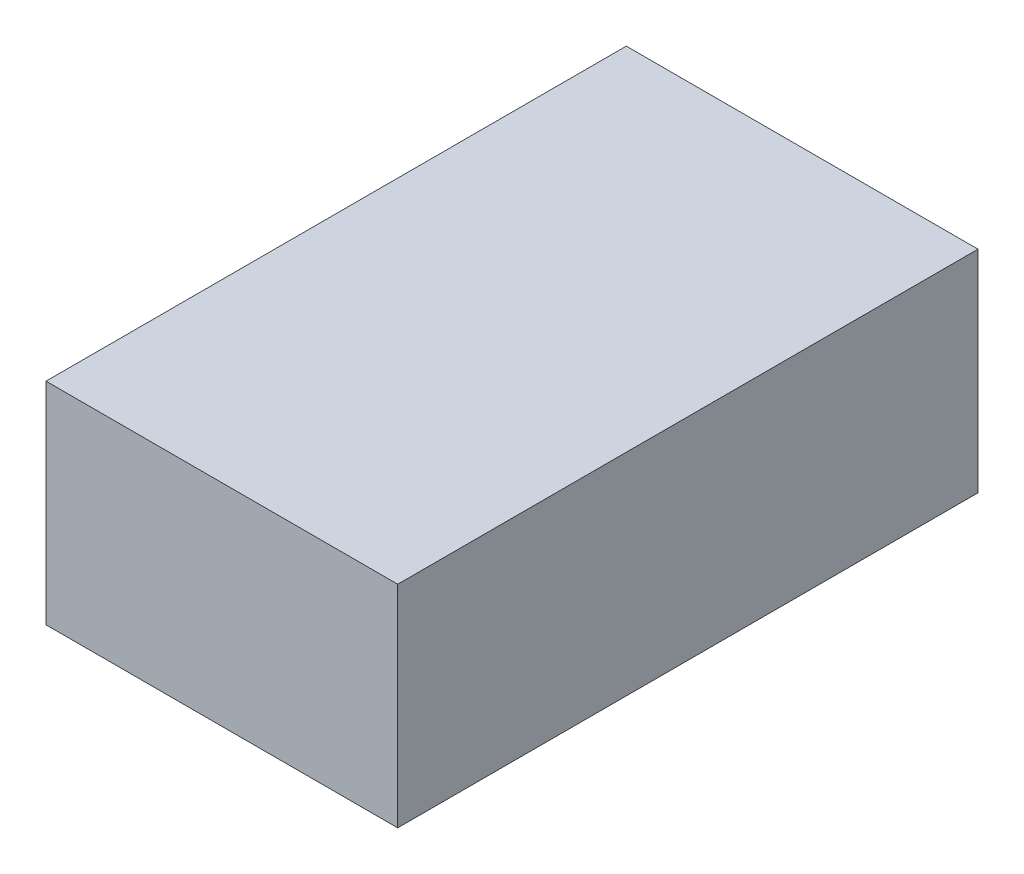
SolidWorks part; units mm, degrees
ref_plane "Front Plane" through (0, 0, 0) normal (1, 0, 0) x (0, 1, 0)
ref_plane "Top Plane" through (0, 0, 0) normal (0, 0, 1) x (0, 1, 0)
ref_plane "Right Plane" through (0, 0, 0) normal (0, 1, 0) x (-1, 0, 0)
sketch "Sketch1" plane through (0, 0, 0) normal (1, 0, 0) x (0, 1, 0)
  line L0 (-19.05, 0) -> (19.05, 0)
  line L1 (19.05, 0) -> (19.05, 104.775)
  line L2 (19.05, 104.775) -> (-19.05, 104.775)
  line L3 (-19.05, 104.775) -> (-19.05, 0)
extrude "Panel_or_block" add sketch "Sketch1" along normal blind 63.5
